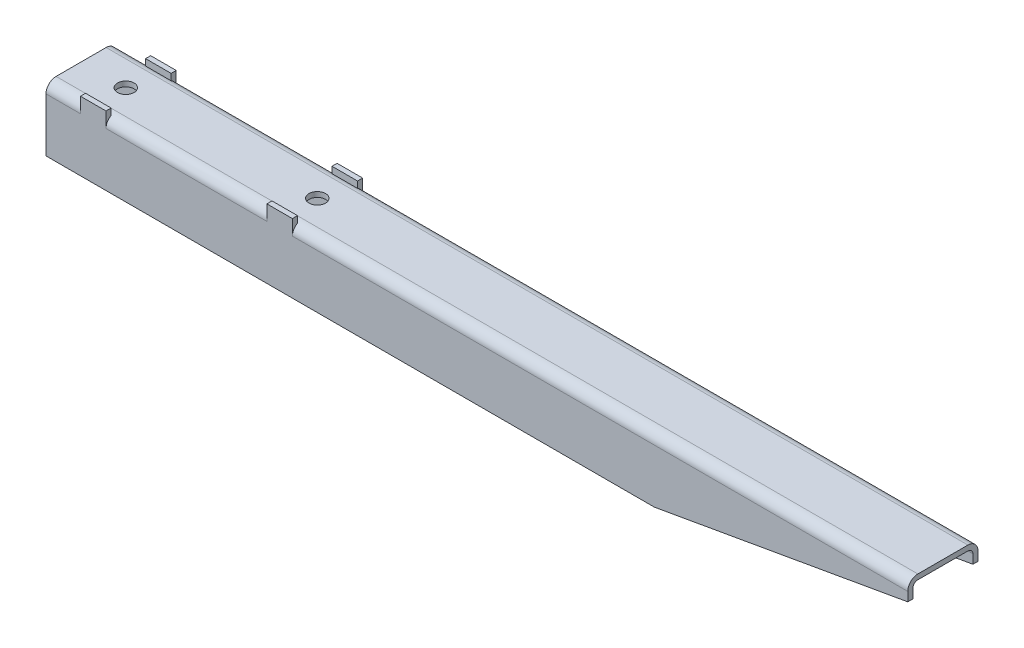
SolidWorks part; units mm, degrees
ref_plane "Ebene vorne" through (0, 0, 0) normal (0, 0, 1) x (1, 0, 0)
ref_plane "Ebene oben" through (0, 0, 0) normal (0, 1, 0) x (1, 0, 0)
ref_plane "Ebene rechts" through (0, 0, 0) normal (1, 0, 0) x (0, 0, -1)
sketch "Skizze1" plane through (0, 0, 0) normal (1, 0, 0) x (0, 0, -1)
  line L0 (-27.5, 0) -> (-27.5, 50)
  line L1 (-27.5, 50) -> (27.5, 50)
  line L2 (27.5, 50) -> (27.5, 0)
  line L3 (27.5, 0) -> (23.5, 0)
  line L4 (23.5, 0) -> (23.5, 46)
  line L5 (23.5, 46) -> (-23.5, 46)
  line L6 (-23.5, 46) -> (-23.5, 0)
  line L7 (-23.5, 0) -> (-27.5, 0)
  line L8 (0, 0) -> (0, 46) construction
  dimension "D1" = 4
  dimension "D2" = 4
  dimension "D3" = 55
  dimension "D4" = 50
  dimension "D5" = 4
extrude "Aufsatz-Linear austragen1" add sketch "Skizze1" along normal blind 675
sketch "Skizze2" plane through (0, 0, 27.5) normal (0, 0, 1) x (1, 0, 0)
  line L0 (675, 35) -> (476.5051, 0)
  line L1 (675, 50) -> (675, 0) construction
  line L2 (675, 0) -> (0, 0) construction
  line L3 (476.5051, 0) -> (675, 0)
  line L4 (675, 0) -> (675, 35)
  line L5 (675, 50) -> (0, 50) construction
  dimension "D1" = 10
  dimension "D2" = 15
extrude "Schnitt-Linear austragen1" cut sketch "Skizze2" against normal blind 780
sketch "Skizze3" plane through (0, 50, 0) normal (0, 1, 0) x (1, 0, 0)
  line L0 (0, 27.5) -> (0, -27.5) construction
  line L1 (35, 0) -> (185, 0) construction
  line L2 (675, 27.5) -> (0, 27.5) construction
  circle A0 centre (35, 0) radius 6.5
  circle A1 centre (185, 0) radius 6.5
  dimension "D1" = 13
  dimension "D2" = 35
  dimension "D4" = 150
  dimension "D3" = 27.5
extrude "Schnitt-Linear austragen3" cut sketch "Skizze3" against normal blind 780
sketch "Skizze4" plane through (0, 50, 0) normal (0, 1, 0) x (1, 0, 0)
  line L0 (675, 27.5) -> (0, 27.5) construction
  line L1 (27, 27.5) -> (47, 27.5)
  line L2 (27, 27.5) -> (27, 23.5)
  line L3 (27, 23.5) -> (47, 23.5)
  line L4 (47, 27.5) -> (47, 23.5)
  line L5 (675, -27.5) -> (0, -27.5) construction
  line L6 (27, -27.5) -> (47, -27.5)
  line L7 (27, -27.5) -> (27, -23.5)
  line L8 (27, -23.5) -> (47, -23.5)
  line L9 (47, -27.5) -> (47, -23.5)
  line L10 (0, 27.5) -> (0, -27.5) construction
  line L11 (173, 27.5) -> (193, 27.5)
  line L12 (173, 27.5) -> (173, 23.5)
  line L13 (173, 23.5) -> (193, 23.5)
  line L14 (193, 27.5) -> (193, 23.5)
  line L15 (173, -23.5) -> (193, -23.5)
  line L16 (173, -23.5) -> (173, -27.5)
  line L17 (173, -27.5) -> (193, -27.5)
  line L18 (193, -23.5) -> (193, -27.5)
  dimension "D1" = 4
  dimension "D2" = 20
  dimension "D3" = 27
  dimension "D4" = 173
extrude "Aufsatz-Linear austragen2" add sketch "Skizze4" along normal blind 4
fillet "Verrundung1" radius 3.9 2 edges at (337.5, 46, -23.5) (337.5, 46, 23.5)
fillet "Verrundung2" radius 7.9 2 edges at (434, 50, 27.5)
